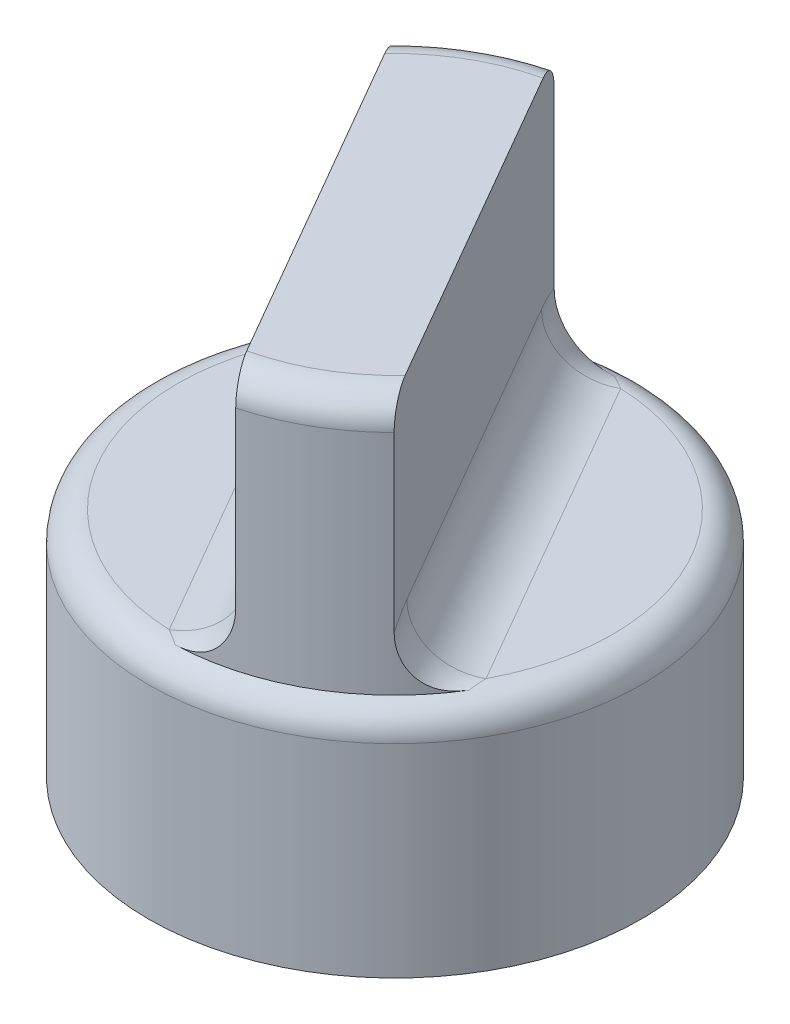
SolidWorks part; units mm, degrees
ref_plane "Front" through (0, 0, 0) normal (0, 0, 1) x (1, 0, 0)
ref_plane "Top" through (0, 0, 0) normal (0, 1, 0) x (1, 0, 0)
ref_plane "Right" through (0, 0, 0) normal (1, 0, 0) x (0, 0, -1)
sketch "Base Sketch" plane through (0, 0, 0) normal (0, 1, 0) x (1, 0, 0)
  circle A0 centre (0, 0) radius 8.5
  dimension "D1" = 17
extrude "Base" add sketch "Base Sketch" along normal blind 8
sketch "Finger Boss Sketch" plane through (0, 8, 0) normal (0, 1, 0) x (-1, 0, 0)
  line L0 (0, 0) -> (-3.9, 6.755) construction
  line L1 (5.5017, -5.5292) -> (-2.0376, 7.5292)
  line L2 (2.0376, -7.5292) -> (-5.5017, 5.5292)
  line L4 (50, 0) -> (-50, 0) construction
  arc A0 (-2.0376, 7.5292) -> (-5.5017, 5.5292) centre (0, 0) ccw
  arc A1 (2.0376, -7.5292) -> (5.5017, -5.5292) centre (0, 0) ccw
  dimension "D1" = 15.6
  dimension "D2" = 4
  dimension "D3" = 120
extrude "Finger Boss" add sketch "Finger Boss Sketch" along normal blind 8.8
fillet "Fillet1" radius 1
fillet "Fillet2" radius 2
